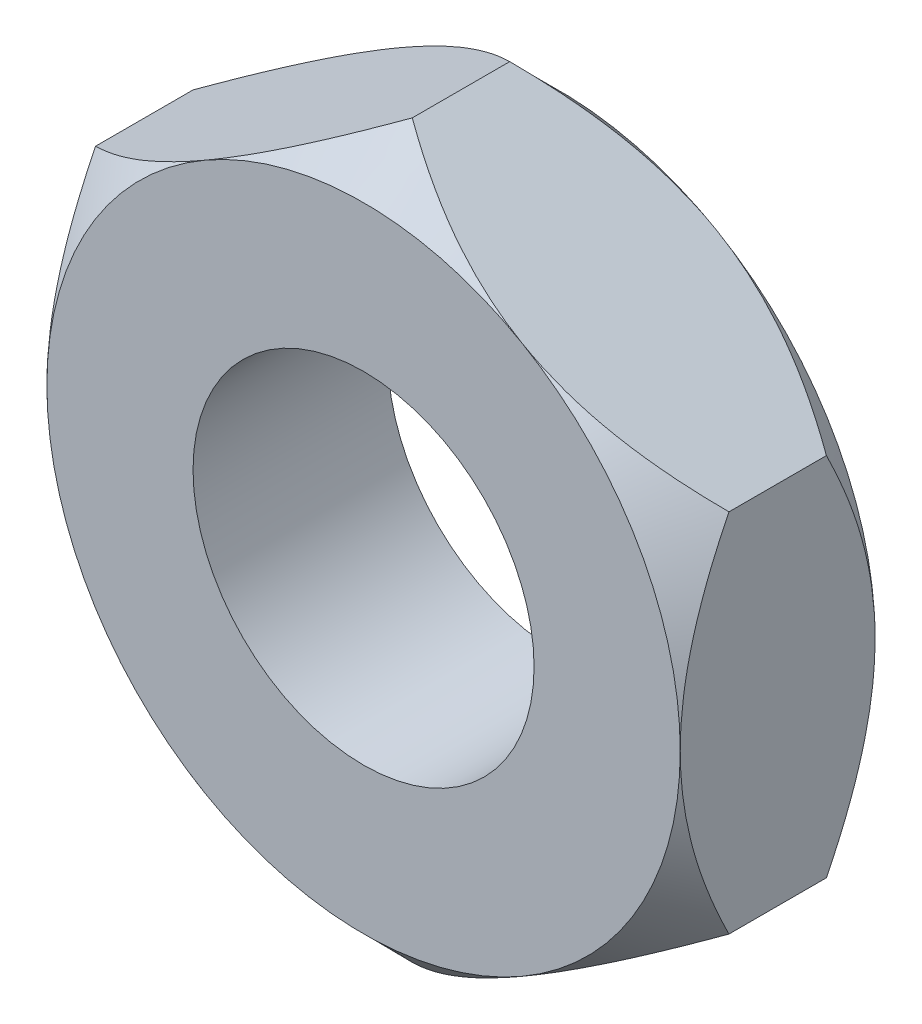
SolidWorks part; units mm, degrees
ref_plane "Plan de face" through (0, 0, 0) normal (0, 0, 1) x (1, 0, 0)
ref_plane "Plan de dessus" through (0, 0, 0) normal (0, 1, 0) x (1, 0, 0)
ref_plane "Plan de droite" through (0, 0, 0) normal (1, 0, 0) x (0, 0, -1)
sketch "Esquisse1" plane through (0, 0, 0) normal (0, 0, 1) x (1, 0, 0)
  line L1 (0, 7.5056) -> (-6.5, 3.7528)
  line L2 (-6.5, 3.7528) -> (-6.5, -3.7528)
  line L3 (-6.5, -3.7528) -> (0, -7.5056)
  line L4 (0, -7.5056) -> (6.5, -3.7528)
  line L5 (6.5, -3.7528) -> (6.5, 3.7528)
  line L6 (6.5, 3.7528) -> (0, 7.5056)
  circle A0 centre (0, 0) radius 6.5 construction
  dimension "D1" = 13
extrude "Extrusion1" add sketch "Esquisse1" along normal mid plane 4
sketch "Esquisse2" plane through (0, 0, 0) normal (1, 0, 0) x (0, 0, -1)
  line L0 (-2, 7.5056) -> (-2, 6.5)
  line L1 (-2, 3.7528) -> (-2, 7.5056) construction
  line L2 (-2, 6.5) -> (-1, 7.5056)
  line L3 (-2, 7.5056) -> (2, 7.5056) construction
  line L4 (-1, 7.5056) -> (-2, 7.5056)
  line L5 (0, 0) -> (-13.9203, 0) construction
  dimension "D1" = 13
  dimension "D2" = 1
revolve "Enlèvement de matière-Révolution1" cut sketch "Esquisse2" angle 360 about L5
mirror "Symétrie2" about plane through (0, 0, 0) normal (0, 0, 1) of "Enlèvement de matière-Révolution1"
hole_wizard "Trou taraudé M8x1.01" positions "Esquisse4" profile "Esquisse3" tap size "M8x1.0" standard "ISO"
sketch "Esquisse4" plane through (0, 0, 2) normal (0, 0, 1) x (1, 0, 0)
  point P0 (0, 0)
sketch "Esquisse3" plane through (0, 0, 2) normal (1, 0, 0) x (0, -1, 0)
  line L0 (0, 0) -> (0, 21.103)
  line L1 (0, 21.103) -> (3.5, 19)
  line L2 (3.5, 19) -> (3.5, 0)
  line L5 (3.5, 0) -> (0, 0)
  line L10 (0, 21.103) -> (-3.5, 19) construction
  line L11 (0, -6.35) -> (0, 107.95) construction
  dimension "Diamètre du trou pour taraudage" = 7
  dimension "Profondeur du trou pour taraudage" = 19
  dimension "Angle de pointe" = 118
